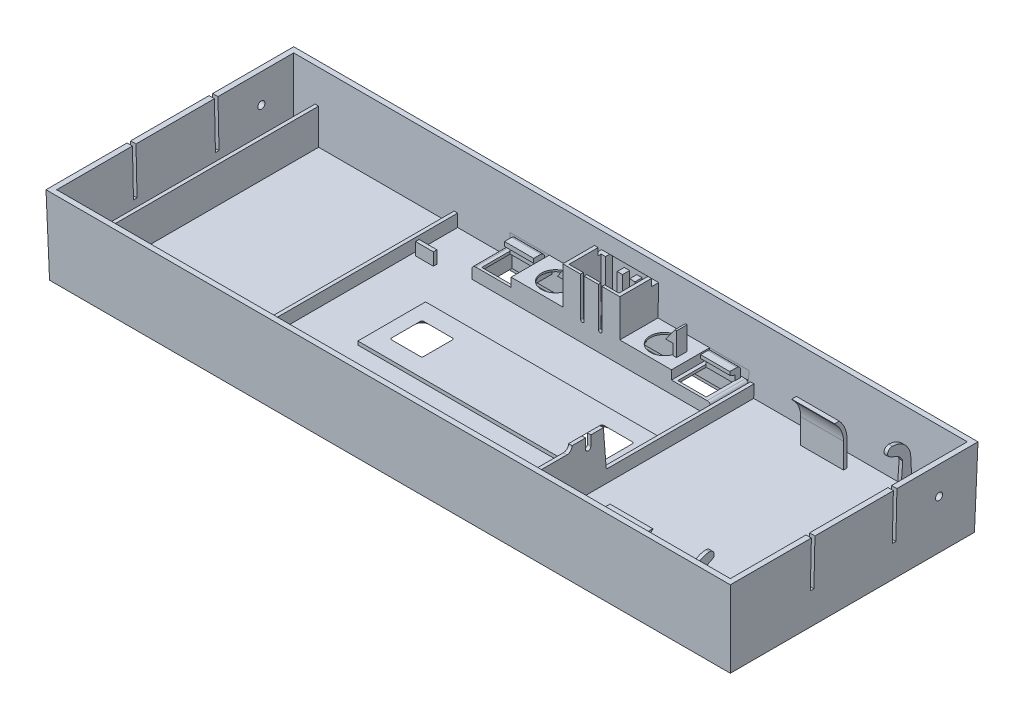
SolidWorks part; units mm, degrees
ref_plane "Plan de face" through (0, 0, 0) normal (0, 0, 1) x (1, 0, 0)
ref_plane "Plan de dessus" through (0, 0, 0) normal (0, 1, 0) x (1, 0, 0)
ref_plane "Plan de droite" through (0, 0, 0) normal (1, 0, 0) x (0, 0, -1)
sketch "Esquisse1" plane through (0, 0, 0) normal (0, 1, 0) x (1, 0, 0)
  line L1 (-95.5, 34.25) -> (95.5, 34.25)
  line L2 (-95.5, 34.25) -> (-95.5, -34.25)
  line L3 (-95.5, -34.25) -> (95.5, -34.25)
  line L4 (95.5, 34.25) -> (95.5, -34.25)
  dimension "D1" = 68.5
  dimension "D2" = 191
  dimension "D3" = 95.5
  dimension "D4" = 34.25
extrude "Extrusion1" add sketch "Esquisse1" along normal blind 22
draft "Dépouille1" type of draft neutral plane draft angle 1.3 faces to draft 2 parameters "D1"=1.3
draft "Dépouille2" type of draft neutral plane draft angle 1.3 faces to draft 2 parameters "D1"=1.3
sketch "Esquisse2" plane through (0, 0, 0) normal (0, -1, 0) x (1, 0, 0)
  line L0 (-95.5, 34.25) -> (95.5, 34.25) construction
  line L1 (-94, 32.75) -> (94, 32.75)
  line L2 (-94, 32.75) -> (-94, -32.75)
  line L3 (-94, -32.75) -> (94, -32.75)
  line L4 (94, 32.75) -> (94, -32.75)
  line L5 (-95.5, -34.25) -> (-95.5, 34.25) construction
  line L6 (95.5, -34.25) -> (-95.5, -34.25) construction
  line L7 (95.5, 34.25) -> (95.5, -34.25) construction
  dimension "D1" = 1.5
  dimension "D2" = 1.5
  dimension "D3" = 1.5
  dimension "D4" = 1.5
extrude "Enlèv. mat.-Extru.1" cut sketch "Esquisse2" against normal blind 1.5
sketch "Esquisse3" plane through (0, 1.5, 0) normal (0, -1, 0) x (1, 0, 0)
  line L0 (94, 32.75) -> (-94, 32.75) construction
  line L1 (-32, 8.25) -> (32.5, 8.25)
  line L2 (-32, 8.25) -> (-32, -7.75)
  line L3 (-32, -7.75) -> (32.5, -7.75)
  line L4 (32.5, 8.25) -> (32.5, -7.75)
  line L5 (-94, 32.75) -> (-94, -32.75) construction
  dimension "D1" = 24.5
  dimension "D2" = 64.5
  dimension "D3" = 16
  dimension "D4" = 62
extrude "Enlèv. mat.-Extru.2" cut sketch "Esquisse3" against normal blind 1
shell "Coque1" thickness 1.5
sketch "Esquisse4" plane through (0, 1.5, 0) normal (0, -1, 0) x (1, 0, 0)
  line L0 (-94, 18.25) -> (-90, 18.25)
  line L1 (-94, 32.75) -> (-94, -32.75) construction
  line L2 (-90, 18.25) -> (-90, -18.25)
  line L3 (-90, -18.25) -> (-94, -18.25)
  line L4 (-94, -18.25) -> (-94, 18.25)
  line L5 (-94, -32.75) -> (94, -32.75) construction
  line L6 (94, 32.75) -> (-94, 32.75) construction
  dimension "D1" = 4
  dimension "D2" = 14.5
  dimension "D3" = 14.5
extrude "Enlèv. mat.-Extru.3" cut sketch "Esquisse4" against normal blind 1.5
sketch "Esquisse5" plane through (0, 1.5, 0) normal (0, -1, 0) x (1, 0, 0)
  line L0 (94, 18.25) -> (90, 18.25)
  line L1 (94, -32.75) -> (94, 32.75) construction
  line L2 (90, 18.25) -> (90, -18.25)
  line L3 (90, -18.25) -> (94, -18.25)
  line L4 (94, -18.25) -> (94, 18.25)
  line L5 (94, 32.75) -> (-94, 32.75) construction
  line L6 (-94, -32.75) -> (94, -32.75) construction
  dimension "D1" = 4
  dimension "D2" = 14.5
  dimension "D3" = 14.5
extrude "Enlèv. mat.-Extru.4" cut sketch "Esquisse5" against normal blind 1.5
sketch "Esquisse6" plane through (0, 2.5, 0) normal (0, -1, 0) x (1, 0, 0)
  line L0 (-29, 4.75) -> (-21, 4.75)
  line L1 (-29, -4.25) -> (-21, -4.25)
  line L2 (-20.5, 4.25) -> (-20.5, -3.75)
  line L3 (-29.5, 4.25) -> (-29.5, -3.75)
  line L4 (-32, 8.25) -> (-32, -7.75) construction
  line L7 (32.5, 8.25) -> (-32, 8.25) construction
  line L8 (-32, -7.75) -> (32.5, -7.75) construction
  arc A0 (-21, 4.75) -> (-20.5, 4.25) centre (-21, 4.25) cw
  arc A1 (-29, 4.75) -> (-29.5, 4.25) centre (-29, 4.25) ccw
  arc A2 (-29.5, -3.75) -> (-29, -4.25) centre (-29, -3.75) ccw
  arc A3 (-21, -4.25) -> (-20.5, -3.75) centre (-21, -3.75) ccw
  dimension "D2" = 8
  dimension "D3" = 8
  dimension "D8" = 0.5
  dimension "D9" = 0.5
  dimension "D1" = 8
  dimension "D4" = 8
  dimension "D5" = 2.5
  dimension "D6" = 3.5
  dimension "D7" = 3.5
extrude "Enlèv. mat.-Extru.5" cut sketch "Esquisse6" against normal through all
sketch "Esquisse7"
  dimension "D2" = 8
  dimension "D3" = 8
  dimension "D4" = 8
  dimension "D8" = 0.5
  dimension "D9" = 0.5
  dimension "D1" = 8
  dimension "D5" = 2.5
  dimension "D6" = 3.5
  dimension "D7" = 3.5
extrude "Enlèv. mat.-Extru.6" cut sketch "Esquisse7" against normal through all
chamfer "Chanfrein1" distance 1.5 angle 45 8 edges at (-29.3536, 2.5, -4.1036) (-25, 2.5, -4.25) (-20.6464, 2.5, -4.1036) (-20.5, 2.5, 0.25) (-20.6464, 2.5, 4.6036) (-25, 2.5, 4.75) (-29.3536, 2.5, 4.6036) (-29.5, 2.5, 0.25)
chamfer "Chanfrein2" distance 1.5 angle 45 8 edges at (21.1464, 2.5, -4.1036) (25.5, 2.5, -4.25) (29.8536, 2.5, -4.1036) (30, 2.5, 0.25) (29.8536, 2.5, 4.6036) (25.5, 2.5, 4.75) (21.1464, 2.5, 4.6036) (21, 2.5, 0.25)
sketch "Esquisse8" plane through (0, 3, 0) normal (0, 1, 0) x (-1, 0, 0)
  line L0 (33.5, -33.2489) -> (-33.5, -33.2489)
  line L1 (-94.4989, -33.2489) -> (94.4989, -33.2489) construction
  line L2 (-33.5, -33.2489) -> (-33.5, -22.2489)
  line L3 (-33.5, -22.2489) -> (33.5, -22.2489)
  line L4 (33.5, -22.2489) -> (33.5, -33.2489)
  dimension "D1" = 67
  dimension "D2" = 33.5
  dimension "D3" = 11
extrude "Extrusion2" add sketch "Esquisse8" along normal blind 16.5
sketch "Esquisse9" plane through (0, 3, 0) normal (0, 1, 0) x (-1, 0, 0)
  line L0 (-34, -33.2489) -> (-34, 33.2489)
  line L1 (-94.4989, -33.2489) -> (94.4989, -33.2489) construction
  line L2 (94.4989, 33.2489) -> (-94.4989, 33.2489) construction
  line L3 (-34, 33.2489) -> (-35, 33.2489)
  line L4 (-35, 33.2489) -> (-35, -33.2489)
  line L5 (-35, -33.2489) -> (-34, -33.2489)
  line L7 (-33.5, -22.2489) -> (-33.5, -33.1921) construction
  dimension "D1" = 1
  dimension "D2" = 66.4977
  dimension "D3" = 0.5
extrude "Extrusion4" add sketch "Esquisse9" along normal blind 14
sketch "Esquisse10" plane through (35, 0, 0) normal (1, 0, 0) x (0, 0, -1)
  line L0 (32.8971, 6.5) -> (-8.1029, 6.5)
  line L1 (33.1354, 17) -> (32.8177, 3) construction
  line L2 (32.8971, 6.5) -> (33.1354, 17)
  line L3 (33.1354, 17) -> (-9.3646, 17)
  line L4 (-33.1354, 17) -> (33.1354, 17) construction
  line L5 (-9.3646, 17) -> (-8.5901, 6.9)
  arc A0 (-8.5901, 6.9) -> (-8.1029, 6.5) centre (-8.1549, 6.9334) ccw
  dimension "D2" = 10.5
  dimension "D5" = 0.4365
  dimension "D1" = 41
  dimension "D3" = 42.5
  dimension "D4" = 10.1
extrude "Enlèv. mat.-Extru.7" cut sketch "Esquisse10" against normal blind 1
sketch "Esquisse11" plane through (35, 0, 0) normal (1, 0, 0) x (0, 0, -1)
  line L0 (-33.1354, 17) -> (-33.1014, 15.5004)
  line L1 (-32.8177, 3) -> (-33.1354, 17) construction
  line L2 (-33.1014, 15.5004) -> (-19.6014, 15.5004)
  line L3 (-33.1354, 17) -> (-18.1354, 17)
  line L4 (-33.1354, 17) -> (-9.3646, 17) construction
  arc A0 (-19.6014, 15.5004) -> (-18.1354, 17) centre (-19.6014, 16.9667) ccw
  dimension "D1" = 15
  dimension "D2" = 1.5
  dimension "D3" = 13.5
extrude "Enlèv. mat.-Extru.8" cut sketch "Esquisse11" against normal blind 1
sketch "Esquisse12" plane through (35, 0, 0) normal (1, 0, 0) x (0, 0, -1)
  line L0 (-12.8646, 17) -> (-12.8646, 14.25)
  line L1 (-18.1354, 17) -> (-9.3646, 17) construction
  line L2 (-14.3646, 17) -> (-14.3646, 14.25)
  line L3 (-14.3646, 17) -> (-12.8646, 17)
  arc A0 (-14.3646, 14.25) -> (-12.8646, 14.25) centre (-13.6146, 14.25) ccw
  dimension "D2" = 0.75
  dimension "D3" = 3.5
  dimension "D1" = 2.75
extrude "Enlèv. mat.-Extru.9" cut sketch "Esquisse12" against normal blind 1
sketch "Esquisse13" plane through (0, 3, 0) normal (0, 1, 0) x (-1, 0, 0)
  line L0 (88.0677, -32.8177) -> (88.0677, 32.8177)
  line L4 (94.0677, -32.8177) -> (33.5, -32.8177) construction
  line L5 (-34, 32.8177) -> (94.0677, 32.8177) construction
  line L6 (88.0677, 32.8177) -> (87.0677, 32.8177)
  line L7 (87.0677, 32.8177) -> (87.0677, -32.8177)
  line L8 (87.0677, -32.8177) -> (88.0677, -32.8177)
  line L9 (94.0677, 32.8177) -> (94.0677, -32.8177) construction
  line L10 (0, 50.5503) -> (0, -52.0962) construction
  line L11 (-87.0677, 32.8177) -> (-87.0677, -32.8177)
  line L12 (-88.0677, -32.8177) -> (-88.0677, 32.8177)
  line L13 (-88.0677, 32.8177) -> (-87.0677, 32.8177)
  line L14 (-87.0677, -32.8177) -> (-88.0677, -32.8177)
  dimension "D1" = 1
  dimension "D2" = 6
extrude "Extrusion5" add sketch "Esquisse13" along normal blind 10
sketch "Esquisse14" plane through (0, 3, 0) normal (0, 1, 0) x (-1, 0, 0)
  line L1 (87.0677, -32.8177) -> (33.5, -32.8177) construction
  line L2 (-34, 32.8177) -> (87.0677, 32.8177) construction
  line L3 (49.0677, -32.8177) -> (48.0677, -32.8177)
  line L4 (49.0677, 32.8177) -> (48.0677, 32.8177)
  line L5 (48.0677, -32.8177) -> (48.0677, 32.8177)
  line L8 (49.0677, -32.8177) -> (49.0677, 32.8177)
  line L9 (87.0677, 32.8177) -> (87.0677, -32.8177) construction
  dimension "D1" = 38
  dimension "D2" = 1
  dimension "D3" = 1
extrude "Extrusion6" add sketch "Esquisse14" along normal blind 3.5
sketch "Esquisse15" plane through (95.4508, -2.1661, 0) normal (0.9997, -0.0227, 0) x (0, 0, -1)
  line L0 (0, -2.6704) -> (0, 30.6885) construction
  line L1 (-11, 24.1723) -> (-11, 11.1723)
  line L2 (-34.7492, 24.1723) -> (34.7492, 24.1723) construction
  line L3 (-11, 24.1723) -> (-12, 24.1723)
  line L4 (-12, 24.1723) -> (-12, 11.1723)
  line L5 (-12, 11.1723) -> (-11, 11.1723)
  line L6 (12, 11.1723) -> (11, 11.1723)
  line L7 (11, 24.1723) -> (11, 11.1723)
  line L8 (12, 24.1723) -> (12, 11.1723)
  line L9 (11, 24.1723) -> (12, 24.1723)
  dimension "D1" = 22
  dimension "D2" = 13
  dimension "D3" = 1
extrude "Enlèv. mat.-Extru.13" cut sketch "Esquisse15" against normal blind 1.5
sketch "Esquisse16" plane through (95.4508, -2.1661, 0) normal (0.9997, -0.0227, 0) x (0, 0, -1)
  line L0 (12, 24.1723) -> (34.7492, 24.1723) construction
  circle A0 centre (24, 16.1723) radius 1
  dimension "D1" = 24
  dimension "D2" = 8
extrude "Enlèv. mat.-Extru.14" cut sketch "Esquisse16" against normal blind 1.5
sketch "Esquisse17" plane through (-95.4508, -2.1661, 0) normal (-0.9997, -0.0227, 0) x (0, 0, 1)
  line L0 (0, -1.9988) -> (0, 29.793) construction
  line L1 (-12, 24.1723) -> (-12, 11.1723)
  line L2 (-34.7492, 24.1723) -> (34.7492, 24.1723) construction
  line L3 (-12, 11.1723) -> (-11, 11.1723)
  line L4 (-11, 11.1723) -> (-11, 24.1723)
  line L5 (-11, 24.1723) -> (-12, 24.1723)
  line L6 (12, 11.1723) -> (11, 11.1723)
  line L7 (11, 11.1723) -> (11, 24.1723)
  line L8 (12, 24.1723) -> (12, 11.1723)
  line L9 (11, 24.1723) -> (12, 24.1723)
  dimension "D1" = 22
  dimension "D2" = 13
  dimension "D3" = 1
extrude "Enlèv. mat.-Extru.15" cut sketch "Esquisse17" against normal blind 1.5
sketch "Esquisse18" plane through (-95.4508, -2.1661, 0) normal (-0.9997, -0.0227, 0) x (0, 0, 1)
  line L0 (-12, 24.1723) -> (-12, 11.1723) construction
  line L1 (-34.7492, 24.1723) -> (-12, 24.1723) construction
  circle A0 centre (-24, 16.1723) radius 1
  dimension "D1" = 12
  dimension "D2" = 8
extrude "Enlèv. mat.-Extru.16" cut sketch "Esquisse18" against normal blind 1.5
sketch "Esquisse19" plane through (0, 3, 0) normal (0, 1, 0) x (-1, 0, 0)
  line L0 (0, 0) -> (52.1984, 0) construction
  line L1 (48.0677, 32.8177) -> (48.0677, -32.8177) construction
  line L2 (47.0677, -21) -> (42.0677, -21)
  line L3 (47.0677, -21) -> (47.0677, -20)
  line L4 (47.0677, -20) -> (42.0677, -20)
  line L5 (42.0677, -21) -> (42.0677, -20)
  line L6 (42.0677, 21) -> (42.0677, 20)
  line L7 (47.0677, 20) -> (42.0677, 20)
  line L8 (47.0677, 21) -> (42.0677, 21)
  line L9 (47.0677, 21) -> (47.0677, 20)
  dimension "D1" = 1
  dimension "D2" = 1
  dimension "D3" = 5
  dimension "D4" = 20
extrude "Extrusion7" add sketch "Esquisse19" along normal blind 3.5
sketch "Esquisse20" plane through (0, 3, 0) normal (0, 1, 0) x (-1, 0, 0)
  line L0 (-34, 32.8177) -> (48.0677, 32.8177) construction
  line L1 (-23.5, 20.8177) -> (-26.5, 20.8177)
  line L2 (-23.5, 20.8177) -> (-23.5, 21.8177)
  line L3 (-23.5, 21.8177) -> (-26.5, 21.8177)
  line L4 (-26.5, 20.8177) -> (-26.5, 21.8177)
  line L5 (-34, 33.1014) -> (-34, 19.6014) construction
  dimension "D1" = 3
  dimension "D2" = 1
  dimension "D3" = 11
  dimension "D4" = 7.5
extrude "Extrusion8" add sketch "Esquisse20" along normal blind 3.5
sketch "Esquisse22" plane through (0, 3, 0) normal (0, 1, 0) x (-1, 0, 0)
  line L0 (0, 0) -> (-102.6284, 0) construction
  line L1 (-35, -32.8177) -> (-87.0677, -32.8177) construction
  line L2 (-81.0677, -31.3177) -> (-80.0677, -31.3177)
  line L3 (-81.0677, -31.3177) -> (-81.0677, -24.3177)
  line L4 (-81.0677, -24.3177) -> (-80.0677, -24.3177)
  line L5 (-80.0677, -31.3177) -> (-80.0677, -24.3177)
  line L6 (-87.0677, -32.8177) -> (-87.0677, 32.8177) construction
  line L7 (-81.0677, 24.3177) -> (-80.0677, 24.3177)
  line L8 (-80.0677, 31.3177) -> (-80.0677, 24.3177)
  line L9 (-81.0677, 31.3177) -> (-81.0677, 24.3177)
  line L10 (-81.0677, 31.3177) -> (-80.0677, 31.3177)
  dimension "D1" = 7
  dimension "D2" = 1
  dimension "D3" = 1.5
  dimension "D4" = 6
extrude "Extrusion10" add sketch "Esquisse22" along normal blind 15
sketch "Esquisse27" plane through (80.0677, 0, 0) normal (-1, 0, 0) x (0, 0, 1)
  line L0 (-21, 17) -> (21, 17)
  line L1 (-21, 3) -> (21, 3)
  line L2 (-31.3177, 3) -> (-24.3177, 3) construction
  line L3 (0, 0) -> (0, 26.6087) construction
  arc A0 (-21, 17) -> (-21, 3) centre (-21, 10) ccw
  arc A1 (21, 17) -> (21, 3) centre (21, 10) cw
  dimension "D4" = 21
  dimension "D1" = 42
  dimension "D2" = 14
  dimension "D3" = 14
extrude "Enlèv. mat.-Extru.21" cut sketch "Esquisse27" against normal blind 1
sketch "Esquisse28" plane through (80.0677, 0, 0) normal (-1, 0, 0) x (0, 0, 1)
  line L0 (0, 0) -> (0, 31.7812) construction
  line L1 (-31.3177, 3) -> (-30.8105, 13)
  line L2 (31.3177, 3) -> (30.8105, 13)
  line L3 (-31.3177, 18) -> (-24.3177, 18) construction
  line L4 (-31.3177, 3) -> (-31.3177, 18)
  line L5 (-31.3177, 18) -> (-25.7223, 18)
  line L6 (31.3177, 18) -> (25.7223, 18)
  line L7 (31.3177, 3) -> (31.3177, 18)
  arc A0 (-30.8105, 13) -> (-25.7223, 18) centre (-25.5475, 12.7331) cw
  arc A1 (30.8105, 13) -> (25.7223, 18) centre (25.5475, 12.7331) ccw
  dimension "D3" = 5.2698
  dimension "D1" = 10
  dimension "D2" = 0.5072
extrude "Enlèv. mat.-Extru.22" cut sketch "Esquisse28" against normal blind 1
sketch "Esquisse29" plane through (80.0677, 0, 0) normal (-1, 0, 0) x (0, 0, 1)
  line L0 (0, 0) -> (0, 33.0676) construction
  line L1 (-27.8177, 3) -> (-28.5655, 13)
  line L2 (-31.3177, 3) -> (-24.3177, 3) construction
  line L3 (-25.5953, 18) -> (-24.1217, 18)
  line L5 (-25.7223, 18) -> (-24.3177, 18) construction
  line L6 (-24.7914, 15.7748) -> (-26.6683, 15.0049)
  line L7 (-24.3177, 18) -> (-24.3177, 16.1638) construction
  line L9 (-24.3177, 3) -> (-27.8177, 3)
  line L12 (-24.1217, 18) -> (-24.3177, 3)
  line L13 (25.5953, 18) -> (24.1217, 18)
  line L14 (24.1217, 18) -> (24.3177, 3)
  line L15 (24.7914, 15.7748) -> (26.6683, 15.0049)
  line L16 (27.8177, 3) -> (28.5655, 13)
  line L17 (24.3177, 3) -> (27.8177, 3)
  arc A1 (-25.5953, 18) -> (-24.7914, 15.7748) centre (-25.5953, 16.7422) cw
  arc A2 (-26.6683, 15.0049) -> (-28.5655, 13) centre (-25.3943, 11.8992) ccw
  arc A3 (25.5953, 18) -> (24.7914, 15.7748) centre (25.5953, 16.7422) ccw
  arc A4 (26.6683, 15.0049) -> (28.5655, 13) centre (25.3943, 11.8992) cw
  dimension "D3" = 2.245
  dimension "D5" = 3.3568
  dimension "D6" = 1.2578
  dimension "D1" = 3.5
  dimension "D2" = 10
  dimension "D4" = 2.0287
  dimension "D7" = 1.2776
  dimension "D8" = 1.0766
  dimension "D9" = 15
extrude "Enlèv. mat.-Extru.23" cut sketch "Esquisse29" against normal blind 1
sketch "Esquisse30" plane through (0, 3, 0) normal (0, 1, 0) x (-1, 0, 0)
  line L0 (0, -46.4128) -> (0, 42.4117) construction
  line L1 (-116.2321, 0) -> (105.029, 0) construction
  line L2 (90, -7.5) -> (90, 7.5)
  line L3 (90, -18.25) -> (90, 18.25) construction
  line L4 (90, 7.5) -> (89, 7.5)
  line L5 (89, 7.5) -> (89, -7.5)
  line L6 (89, -7.5) -> (90, -7.5)
  line L7 (-90, 7.5) -> (-89, 7.5)
  line L8 (-90, -7.5) -> (-90, 7.5)
  line L9 (-89, 7.5) -> (-89, -7.5)
  line L10 (-89, -7.5) -> (-90, -7.5)
  dimension "D1" = 1
  dimension "D2" = 15
  dimension "D3" = 7.5
extrude "Extrusion11" add sketch "Esquisse30" along normal blind 4
sketch "Esquisse31" plane through (-90, 0, 0) normal (-1, 0, 0) x (0, 0, 1)
  line L0 (-12.5344, 3) -> (8.8412, 3) construction
  line L1 (32.8177, 3) -> (-32.8177, 3) construction
  line L2 (0, 0) -> (0, 10.0487) construction
  line L3 (-7.5, 7) -> (-5.5, 7)
  line L4 (-7.5, 7) -> (7.5, 7) construction
  line L5 (-5.5, 7) -> (-5.5, 5)
  line L6 (-5.5, 5) -> (-7.5, 5)
  line L7 (-7.5, 5) -> (-7.5, 7)
  line L8 (5.5, 5) -> (7.5, 5)
  line L9 (5.5, 7) -> (5.5, 5)
  line L10 (7.5, 7) -> (5.5, 7)
  line L11 (7.5, 5) -> (7.5, 7)
  dimension "D1" = 2
  dimension "D2" = 2
  dimension "D3" = 11
extrude "Extrusion12" add sketch "Esquisse31" along normal blind 1
ref_plane "Plan1" through (-90, 5, -7.5) normal (0, -1, 0) x (1, 0, 0)
sketch "Esquisse34" plane through (0, 0, -7.5) normal (0, 0, -1) x (-1, 0, 0)
  line L0 (90, 5) -> (91, 7)
  line L1 (91, 7) -> (91, 5)
  line L2 (91, 5) -> (90, 5)
extrude "Enlèv. mat.-Extru.25" cut sketch "Esquisse34" against normal blind 15
sketch "Esquisse35" plane through (90, 0, 0) normal (1, 0, 0) x (0, 0, -1)
  line L0 (-7.2744, 3) -> (6.7148, 3) construction
  line L1 (32.8177, 3) -> (-32.8177, 3) construction
  line L2 (0, 0) -> (0, 14.4134) construction
  line L3 (-5.5, 5) -> (-5.5, 7)
  line L5 (-7.5, 7) -> (7.5, 7) construction
  line L6 (-5.5, 7) -> (-7.5, 7)
  line L7 (-7.5, 7) -> (-7.5, 5)
  line L8 (-7.5, 5) -> (-5.5, 5)
  line L9 (5.5, 5) -> (5.5, 7)
  line L10 (7.5, 5) -> (5.5, 5)
  line L11 (7.5, 7) -> (7.5, 5)
  line L12 (5.5, 7) -> (7.5, 7)
  dimension "D1" = 2
  dimension "D2" = 11
  dimension "D3" = 2
extrude "Extrusion14" add sketch "Esquisse35" along normal blind 1
sketch "Esquisse36" plane through (0, 0, -7.5) normal (0, 0, -1) x (-1, 0, 0)
  line L0 (-90, 5) -> (-91, 7)
  line L1 (-91, 7) -> (-91, 5)
  line L2 (-91, 5) -> (-90, 5)
extrude "Enlèv. mat.-Extru.26" cut sketch "Esquisse36" against normal blind 15
sketch "Esquisse38" plane through (0, -0.7428, 32.7328) normal (0, 0.0227, -0.9997) x (-1, 0, 0)
  line L0 (40.0677, 13.2438) -> (40.0677, 8.2438)
  line L1 (40.0677, 8.2438) -> (34.0677, 8.2438)
  line L2 (34.0677, 13.2438) -> (35.0677, 13.2438)
  line L3 (35.0677, 13.2438) -> (35.0677, 9.2438)
  line L4 (40.0677, 13.2438) -> (39.0677, 13.2438)
  line L5 (39.0677, 13.2438) -> (39.0677, 9.2438)
  line L6 (39.0677, 9.2438) -> (35.0677, 9.2438)
  line L7 (34.0677, 13.2438) -> (34.0677, 8.2438)
  line L8 (48.0677, 7.2429) -> (48.0677, 3.7438) construction
  line L9 (-34, 3.7438) -> (48.0677, 3.7438) construction
  dimension "D1" = 8
  dimension "D2" = 1
  dimension "D3" = 5
  dimension "D4" = 4
  dimension "D5" = 1
  dimension "D6" = 6
  dimension "D7" = 4.5
extrude "Extrusion15" add sketch "Esquisse38" along normal blind 2
sketch "Esquisse39" plane through (-40.0677, 0, 0) normal (-1, 0, 0) x (0, 0, 1)
  line L0 (30.9657, 9.5437) -> (33.0332, 12.4976)
  line L1 (30.9203, 7.5442) -> (31.0337, 12.5429) construction
  line L2 (30.9203, 7.5442) -> (32.9198, 7.4988) construction
  line L3 (30.9657, 9.5437) -> (31.0337, 12.5429)
  line L4 (31.0337, 12.5429) -> (33.0332, 12.4976)
  dimension "D1" = 2
extrude "Enlèv. mat.-Extru.27" cut sketch "Esquisse39" against normal blind 6
sketch "Esquisse40" plane through (0, -0.7428, 32.7328) normal (0, 0.0227, -0.9997) x (-1, 0, 0)
  line L0 (0, 0) -> (0, 36.7181) construction
  line L1 (-7, 22.7487) -> (-7, 17.7487)
  line L2 (94.4989, 22.7487) -> (-94.4989, 22.7487) construction
  line L3 (7, 22.7487) -> (7, 17.7487)
  line L4 (-7, 22.7487) -> (7, 22.7487)
  arc A0 (-7, 17.7487) -> (7, 17.7487) centre (0, 17.7487) ccw
  dimension "D1" = 5
  dimension "D2" = 14
  dimension "D3" = 7
extrude "Enlèv. mat.-Extru.28" cut sketch "Esquisse40" against normal blind 0.5
sketch "Esquisse41" plane through (0, 1.5, 0) normal (0, -1, 0) x (1, 0, 0)
  line L0 (0, 0) -> (0, -60.4167) construction
  line L1 (-94, -32.75) -> (94, -32.75) construction
  line L2 (32, -23) -> (-32, -23)
  line L3 (32, -23) -> (32, -32)
  line L4 (32, -32) -> (-32, -32)
  line L5 (-32, -23) -> (-32, -32)
  dimension "D1" = 64
  dimension "D2" = 9
  dimension "D3" = 32
  dimension "D4" = 0.75
extrude "Enlèv. mat.-Extru.29" cut sketch "Esquisse41" against normal blind 4.25
sketch "Esquisse42" plane through (0, 1.5, 0) normal (0, -1, 0) x (1, 0, 0)
  line L0 (0, 0) -> (0, -58.016) construction
  line L1 (32, -23) -> (-32, -23) construction
  line L2 (31.5, -23) -> (23.5, -23)
  line L3 (31.5, -23) -> (31.5, -31)
  line L4 (31.5, -31) -> (23.5, -31)
  line L5 (23.5, -23) -> (23.5, -31)
  line L6 (32, -32) -> (32, -23) construction
  line L7 (-31.5, -31) -> (-23.5, -31)
  line L8 (-31.5, -23) -> (-31.5, -31)
  line L9 (-23.5, -23) -> (-23.5, -31)
  line L10 (-31.5, -23) -> (-23.5, -23)
  dimension "D1" = 8
  dimension "D2" = 8
  dimension "D3" = 0.5
  dimension "D4" = 8
extrude "Enlèv. mat.-Extru.30" cut sketch "Esquisse42" against normal through all
sketch "Esquisse43" plane through (0, 5.75, 0) normal (0, -1, 0) x (1, 0, 0)
  line L0 (0, 0) -> (0, -60.4167) construction
  line L1 (23.5, -31) -> (23.5, -23) construction
  line L2 (20.75, -23) -> (-20.75, -23)
  line L3 (20.75, -23) -> (20.75, -32)
  line L4 (20.75, -32) -> (-20.75, -32)
  line L5 (-20.75, -23) -> (-20.75, -32)
  line L6 (-23.5, -23) -> (-23.5, -31) construction
  line L8 (-32, -32) -> (32, -32) construction
  dimension "D1" = 2.75
  dimension "D2" = 2.75
  dimension "D3" = 9
  dimension "D4" = 9
extrude "Enlèv. mat.-Extru.31" cut sketch "Esquisse43" against normal blind 2.75
sketch "Esquisse44" plane through (0, 8.5, 0) normal (0, -1, 0) x (1, 0, 0)
  line L0 (0, 0) -> (0, -52.0144) construction
  line L1 (-32, -32) -> (32, -32) construction
  line L2 (7, -23) -> (-7, -23)
  line L3 (7, -23) -> (7, -32)
  line L4 (7, -32) -> (-7, -32)
  line L5 (-7, -23) -> (-7, -32)
  dimension "D1" = 14
  dimension "D2" = 7
  dimension "D3" = 9
  dimension "D4" = 9
extrude "Enlèv. mat.-Extru.32" cut sketch "Esquisse44" against normal through all
sketch "Esquisse45" plane through (0, 8.5, 0) normal (0, -1, 0) x (1, 0, 0)
  line L0 (20.75, -32) -> (20.75, -23) construction
  line L1 (-32, -32) -> (32, -32) construction
  line L2 (0, 0) -> (0, -38.2871) construction
  circle A0 centre (15.25, -27.5) radius 4
  circle A1 centre (-15.25, -27.5) radius 4
  dimension "D1" = 8
  dimension "D2" = 5.5
  dimension "D3" = 4.5
extrude "Enlèv. mat.-Extru.33" cut sketch "Esquisse45" against normal through all
sketch "Esquisse46" plane through (0, 19.5, 0) normal (0, 1, 0) x (-1, 0, 0)
  line L0 (0, 0) -> (0, -52.0144) construction
  line L1 (-94.4989, -33.2489) -> (94.4989, -33.2489) construction
  line L2 (8, -33.2489) -> (33.5, -33.2489)
  line L3 (8, -33.2489) -> (8, -22.2489)
  line L4 (8, -22.2489) -> (33.5, -22.2489)
  line L5 (33.5, -33.2489) -> (33.5, -22.2489)
  line L6 (-8, -22.2489) -> (-33.5, -22.2489)
  line L7 (-33.5, -33.2489) -> (-33.5, -22.2489)
  line L8 (-8, -33.2489) -> (-33.5, -33.2489)
  line L9 (-8, -33.2489) -> (-8, -22.2489)
  dimension "D1" = 8
  dimension "D2" = 11
  dimension "D3" = 11
  dimension "D4" = 25.5
extrude "Enlèv. mat.-Extru.34" cut sketch "Esquisse46" against normal blind 10.5
sketch "Esquisse47" plane through (-33.5, 0, 0) normal (1, 0, 0) x (0, 0, -1)
  line L0 (32.9539, 9) -> (33.2489, 9)
  line L2 (32.9539, 9) -> (33.2011, 19.8959)
  line L3 (33.2011, 19.8959) -> (33.4762, 19.8959)
  line L4 (33.4762, 19.8959) -> (33.2489, 9)
extrude "Extrusion18" add sketch "Esquisse47" along normal blind 26
sketch "Esquisse48" plane through (33.5, 0, 0) normal (-1, 0, 0) x (0, 0, 1)
  line L0 (-32.9539, 9) -> (-33.1952, 19.6335)
  line L1 (-33.1952, 19.6335) -> (-33.3374, 19.5729)
  line L2 (-33.3374, 19.5729) -> (-33.2489, 9)
  line L3 (-33.2489, 9) -> (-32.9539, 9)
extrude "Extrusion19" add sketch "Esquisse48" along normal blind 26
sketch "Esquisse49" plane through (0, 9, 0) normal (0, 1, 0) x (-1, 0, 0)
  line L0 (0, 0) -> (0, -72.42) construction
  line L3 (8, -32.9539) -> (33.5, -32.9539) construction
  line L4 (22.5, -32.9539) -> (33.5, -32.9539)
  line L5 (22.5, -32.9539) -> (22.5, -21.9539)
  line L8 (22.5, -21.9539) -> (33.5, -21.9539)
  line L9 (33.5, -32.9539) -> (33.5, -21.9539)
  line L10 (33.5, -32.9539) -> (33.5, -22.2489) construction
  line L11 (-22.5, -21.9539) -> (-33.5, -21.9539)
  line L12 (-33.5, -32.9539) -> (-33.5, -21.9539)
  line L13 (-22.5, -32.9539) -> (-22.5, -21.9539)
  line L14 (-22.5, -32.9539) -> (-33.5, -32.9539)
  dimension "D1" = 11
  dimension "D2" = 11
  dimension "D3" = 11
  dimension "D4" = 11
extrude "Enlèv. mat.-Extru.36" cut sketch "Esquisse49" against normal blind 2.5
sketch "Esquisse53" plane through (0, 6.5, 0) normal (0, 1, 0) x (-1, 0, 0)
  line L0 (0, 0) -> (0, -39.4915) construction
  line L1 (23.5, -31) -> (31.5, -31) construction
  line L2 (23.4, -32.5) -> (31.6, -32.5)
  line L3 (23.4, -32.5) -> (23.4, -29.5)
  line L4 (23.4, -29.5) -> (31.6, -29.5)
  line L5 (31.6, -32.5) -> (31.6, -29.5)
  line L7 (23.5, -23) -> (23.5, -31) construction
  line L8 (-31.6, -32.5) -> (-31.6, -29.5)
  line L9 (-23.4, -29.5) -> (-31.6, -29.5)
  line L10 (-23.4, -32.5) -> (-31.6, -32.5)
  line L11 (-23.4, -32.5) -> (-23.4, -29.5)
  dimension "D1" = 3
  dimension "D2" = 1.5
  dimension "D3" = 8.2
  dimension "D4" = 8.1
extrude "Extrusion25" add sketch "Esquisse53" along normal blind 3
sketch "Esquisse54" plane through (-31.6, 0, 0) normal (-1, 0, 0) x (0, 0, 1)
  line L0 (-32.5, 6.5) -> (-29.5, 6.5) construction
  line L1 (-31, 8) -> (-29.5, 8)
  line L2 (-31, 8) -> (-31, 6.5)
  line L3 (-31, 6.5) -> (-29.5, 6.5)
  line L4 (-29.5, 8) -> (-29.5, 6.5)
  line L5 (-29.5, 9.5) -> (-29.5, 6.5) construction
  dimension "D1" = 1.5
  dimension "D2" = 1.5
  dimension "D3" = 1.5
  dimension "D4" = 1.5
extrude "Enlèv. mat.-Extru.37" cut sketch "Esquisse54" against normal blind 8.2
sketch "Esquisse55" plane through (31.6, 0, 0) normal (1, 0, 0) x (0, 0, -1)
  line L0 (29.5, 6.5) -> (32.5, 6.5) construction
  line L1 (29.5, 8) -> (31, 8)
  line L2 (29.5, 8) -> (29.5, 6.5)
  line L3 (29.5, 6.5) -> (31, 6.5)
  line L4 (31, 8) -> (31, 6.5)
  line L5 (29.5, 9.5) -> (29.5, 6.5) construction
  dimension "D1" = 1.5
  dimension "D2" = 1.5
  dimension "D3" = 1.5
  dimension "D4" = 1.5
extrude "Enlèv. mat.-Extru.38" cut sketch "Esquisse55" against normal blind 8.2
fillet "Congé2" radius 1 1 edges at (27.5, 9.5, -32.5)
chamfer "Chanfrein3" distance 1 angle 30 1 edges at (27.5, 8, -29.5)
fillet "Congé3" radius 1 1 edges at (-27.5, 9.5, -32.5)
chamfer "Chanfrein4" distance 0.5 angle 30 1 edges at (-27.5, 8, -29.5)
fillet "Congé4" radius 1 1 edges at (-33.5, 6.5, -27.573)
fillet "Congé5" radius 1 1 edges at (33.5, 6.5, -27.573)
sketch "Esquisse56" plane through (0, 9, 0) normal (0, 1, 0) x (-1, 0, 0)
  line L0 (-14.8406, -27.4147) -> (-26.4264, -27.4147) construction
  line L1 (-8, -22.2489) -> (-22.5, -22.2489) construction
  line L2 (-20.25, -28.9189) -> (-17.25, -28.9189)
  line L3 (-20.25, -28.9189) -> (-20.25, -25.9189)
  line L4 (-20.25, -25.9189) -> (-17.25, -25.9189)
  line L5 (-17.25, -28.9189) -> (-17.25, -25.9189)
  line L6 (-15.25, -32) -> (-15.25, -20.1969) construction
  line L7 (-7, -32) -> (-20.75, -32) construction
  line L9 (-19.25, -30.7181) -> (-19.25, -23.5787) construction
  line L10 (-22.5, -32.9539) -> (-22.5, -22.2489) construction
  dimension "D4" = 1
  dimension "D1" = 3
  dimension "D2" = 6.67
  dimension "D3" = 3
  dimension "D5" = 2.25
sketch "Esquisse57" plane through (0, 9, 0) normal (0, 1, 0) x (-1, 0, 0)
  line L0 (15.2094, -31.0033) -> (15.2094, -20.8266) construction
  line L1 (15.25, -27.5) -> (7, -27.5) construction
  line L2 (7, -23) -> (7, -32) construction
  line L3 (11.25, -29.9631) -> (11.25, -24.2641) construction
  line L4 (10.25, -29) -> (13.25, -29)
  line L5 (10.25, -29) -> (10.25, -26)
  line L6 (10.25, -26) -> (13.25, -26)
  line L7 (13.25, -29) -> (13.25, -26)
  line L8 (8, -22.2489) -> (8, -33.1921) construction
  dimension "D1" = 3
  dimension "D2" = 1.5
  dimension "D3" = 3
  dimension "D4" = 1
  dimension "D5" = 2.25
extrude "Extrusion27" add sketch "Esquisse57" along normal blind 6.5
extrude "Extrusion28" add sketch "Esquisse56" along normal blind 6.5 contours L5 L4 L3 L2
sketch "Esquisse58" plane through (0, 0, -26) normal (0, 0, 1) x (1, 0, 0)
  line L0 (-10.75, 15.5) -> (-13.25, 12)
  line L1 (-13.25, 15.5) -> (-10.25, 15.5) construction
  line L2 (-13.25, 15.5) -> (-13.25, 9) construction
  line L3 (-13.25, 12) -> (-13.25, 15.5)
  line L4 (-13.25, 15.5) -> (-10.75, 15.5)
  dimension "D1" = 2.5
  dimension "D2" = 3.5
extrude "Enlèv. mat.-Extru.39" cut sketch "Esquisse58" against normal blind 3
sketch "Esquisse59" plane through (0, 0, -26) normal (0, 0, 1) x (1, 0, 0)
  line L1 (-13.25, 12) -> (-13.25, 9) construction
  line L2 (-13.25, 11.99) -> (-11.25, 11.99)
  line L3 (-13.25, 11.99) -> (-13.25, 9)
  line L4 (-13.25, 9) -> (-11.25, 9)
  line L6 (-11.25, 11.99) -> (-11.25, 9)
  line L7 (-11.5419, 9) -> (-10.25, 9) construction
  dimension "D1" = 2
  dimension "D2" = 2
  dimension "D3" = 2.99
  dimension "D4" = 2.99
extrude "Enlèv. mat.-Extru.40" cut sketch "Esquisse59" against normal blind 3
sketch "Esquisse60" plane through (0, 0, -25.9189) normal (0, 0, 1) x (1, 0, 0)
  line L0 (19.75, 15.5) -> (17.25, 12)
  line L1 (20.25, 15.5) -> (17.25, 15.5) construction
  line L2 (17.25, 15.5) -> (17.25, 9) construction
  line L3 (17.25, 12) -> (17.25, 15.5)
  line L4 (17.25, 15.5) -> (19.75, 15.5)
  dimension "D1" = 2.5
  dimension "D2" = 3.5
extrude "Enlèv. mat.-Extru.41" cut sketch "Esquisse60" against normal blind 3
sketch "Esquisse61" plane through (0, 0, -25.9189) normal (0, 0, 1) x (1, 0, 0)
  line L0 (20.25, 9) -> (18.9242, 9) construction
  line L1 (17.25, 11.99) -> (19.25, 11.99)
  line L2 (17.25, 11.99) -> (17.25, 9)
  line L3 (17.25, 9) -> (19.25, 9)
  line L4 (19.25, 11.99) -> (19.25, 9)
  dimension "D1" = 2.99
  dimension "D2" = 2.99
  dimension "D3" = 2
  dimension "D4" = 2
extrude "Enlèv. mat.-Extru.42" cut sketch "Esquisse61" against normal blind 3
sketch "Esquisse62" plane through (0, 0, -22.2489) normal (0, 0, 1) x (1, 0, 0)
  line L0 (0, -9.3688) -> (0, 44.543) construction
  line L1 (-8, 19.5) -> (8, 19.5) construction
  line L2 (-3, 22.3726) -> (-2, 22.3726)
  line L3 (-3, 22.3726) -> (-3, 8)
  line L4 (-3, 8) -> (-2, 8)
  line L5 (-2, 22.3726) -> (-2, 8)
  line L6 (3, 8) -> (2, 8)
  line L7 (2, 22.3726) -> (2, 8)
  line L8 (3, 22.3726) -> (3, 8)
  line L9 (3, 22.3726) -> (2, 22.3726)
  dimension "D1" = 1
  dimension "D2" = 11.5
  dimension "D3" = 4
extrude "Enlèv. mat.-Extru.43" cut sketch "Esquisse62" against normal blind 3
fillet "Congé6" radius 0.5 1 edges at (-3, 8, -22.6244)
fillet "Congé7" radius 0.5 1 edges at (-2, 8, -22.6244)
fillet "Congé8" radius 0.5 1 edges at (3, 8, -22.6244)
fillet "Congé9" radius 0.5 1 edges at (2, 8, -22.6244)
sketch "Esquisse63" plane through (0, 0, -23) normal (0, 0, -1) x (-1, 0, 0)
  line L0 (-2, 19.5) -> (-2, 8.5) construction
  line L1 (-2, 15) -> (2, 15)
  line L2 (-2, 15) -> (-2, 11.5)
  line L3 (-2, 11.5) -> (2, 11.5)
  line L4 (2, 15) -> (2, 11.5)
  line L5 (2, 8.5) -> (2, 19.5) construction
  line L6 (-2, 19.5) -> (2, 19.5) construction
  line L7 (-4.7371, 1.5) -> (4.0661, 1.5) construction
  line L8 (-32, 1.5) -> (32, 1.5) construction
  dimension "D1" = 4.5
  dimension "D2" = 10
extrude "Extrusion29" add sketch "Esquisse63" along normal blind 4.5
sketch "Esquisse64" plane through (-2, 0, 0) normal (-1, 0, 0) x (0, 0, 1)
  line L0 (-24.4667, 11.5) -> (-22.0218, 11.5) construction
  line L1 (-27.5, 11.5) -> (-23, 11.5) construction
  line L2 (-22.6523, 15.0426) -> (-28.0966, 15.0426) construction
  line L3 (-23, 15.7973) -> (-23, 10.6103) construction
  line L4 (-23, 19.5) -> (-23, 8.5) construction
  line L5 (-27.5, 15.5) -> (-27.5, 11.1696) construction
  line L6 (-29, 15.5) -> (-26, 15.5) construction
  line L7 (-26.84, 15.0426) -> (-27.5, 14.1024)
  line L8 (-27.5, 14.1024) -> (-23.2442, 11.5)
  line L9 (-23.2442, 11.5) -> (-23.2442, 11.1696)
  line L10 (-23.2442, 11.1696) -> (-28.2678, 11.1696)
  line L11 (-28.2678, 11.1696) -> (-28.2678, 15.5)
  line L12 (-28.2678, 15.5) -> (-26.84, 15.5)
  line L13 (-26.84, 15.5) -> (-26.84, 15.0426)
extrude "Enlèv. mat.-Extru.44" cut sketch "Esquisse64" against normal blind 4
sketch "Esquisse65" plane through (8, 0, 0) normal (1, 0, 0) x (0, 0, -1)
  line L0 (33.1921, 19.5) -> (33.1467, 17.5)
  line L1 (33.1921, 19.5) -> (32.9539, 9) construction
  line L2 (33.1467, 17.5) -> (31.1467, 17.5)
  line L3 (31.1467, 17.5) -> (31.1467, 19.5)
  line L4 (33.1921, 19.5) -> (22.2489, 19.5) construction
  line L5 (31.1467, 19.5) -> (33.1921, 19.5)
  dimension "D1" = 2
  dimension "D2" = 2
extrude "Enlèv. mat.-Extru.45" cut sketch "Esquisse65" against normal blind 17
sketch "Esquisse66" plane through (0, 0, -32) normal (0, 0, 1) x (1, 0, 0)
  line L0 (0, 1.5) -> (0, 34.1047) construction
  line L1 (-32, 1.5) -> (32, 1.5) construction
  line L2 (-5.75, 17.5) -> (-5.75, 2.5)
  line L3 (7, 17.5) -> (-7, 17.5) construction
  line L4 (-5.75, 2.5) -> (-2.5, 2.5)
  line L5 (-2.5, 2.5) -> (-2.5, 15.5)
  line L6 (-2.5, 15.5) -> (-1, 15.5)
  line L7 (-1, 15.5) -> (-1, 2.5)
  line L8 (-1, 2.5) -> (1, 2.5)
  line L9 (-5.75, 17.5) -> (5.75, 17.5)
  line L10 (1, 15.5) -> (1, 2.5)
  line L11 (2.5, 15.5) -> (1, 15.5)
  line L12 (2.5, 2.5) -> (2.5, 15.5)
  line L13 (5.75, 2.5) -> (2.5, 2.5)
  line L14 (5.75, 17.5) -> (5.75, 2.5)
  point P16 (0, 2.5)
  point P21 (0, 17.5)
  dimension "D1" = 2
  dimension "D2" = 1.5
  dimension "D3" = 11.5
  dimension "D4" = 2
  dimension "D5" = 15
  dimension "D6" = 15
extrude "Enlèv. mat.-Extru.46" cut sketch "Esquisse66" against normal blind 2
sketch "Esquisse67" plane through (0, 3, 0) normal (0, 1, 0) x (-1, 0, 0)
  line L0 (-3.4009, 0) -> (-105.4291, 0) construction
  line L1 (-35, 8.1029) -> (-35, -32.8971) construction
  line L2 (-65, -29) -> (-53, -29)
  line L3 (-65, -29) -> (-65, -25.5)
  line L4 (-65, -25.5) -> (-53, -25.5)
  line L5 (-53, -29) -> (-53, -25.5)
  line L6 (-53, 29) -> (-53, 25.5)
  line L7 (-65, 25.5) -> (-53, 25.5)
  line L8 (-65, 29) -> (-65, 25.5)
  line L9 (-65, 29) -> (-53, 29)
  dimension "D1" = 3.5
  dimension "D2" = 12
  dimension "D3" = 29
  dimension "D4" = 18
extrude "Extrusion30" add sketch "Esquisse67" along normal blind 12.5
sketch "Esquisse69" plane through (53, 0, 0) normal (-1, 0, 0) x (0, 0, 1)
  line L0 (0, 0) -> (0, 31.8719) construction
  line L1 (-31.7963, 10) -> (-20.7895, 10) construction
  line L2 (-29, 3) -> (-25.5, 3) construction
  line L3 (-29, 15.5) -> (-29, 3) construction
  line L4 (-29, 10) -> (-29, 15.5)
  line L5 (-21, 14.5221) -> (-21, 7.8622) construction
  line L6 (-28, 3) -> (-28, 10)
  line L8 (-25.5, 15.5) -> (-25.5, 3) construction
  line L9 (-25.5, 15.3619) -> (-25.5, 3)
  line L10 (-25.5, 3) -> (-28, 3)
  line L11 (-29, 15.5) -> (-25.5, 15.5) construction
  line L12 (-26.8095, 15.5) -> (-29, 15.5)
  line L13 (28, 3) -> (28, 10)
  line L14 (25.5, 3) -> (28, 3)
  line L15 (25.5, 15.3619) -> (25.5, 3)
  line L16 (29, 10) -> (29, 15.5)
  line L17 (26.8095, 15.5) -> (29, 15.5)
  arc A0 (-28, 10) -> (-25.5, 15.3619) centre (-21, 10) cw
  arc A1 (-29, 10) -> (-26.8095, 15.5) centre (-21, 10) cw
  arc A2 (28, 10) -> (25.5, 15.3619) centre (21, 10) ccw
  arc A3 (29, 10) -> (26.8095, 15.5) centre (21, 10) ccw
  dimension "D2" = 7
  dimension "D1" = 7
  dimension "D3" = 1
extrude "Enlèv. mat.-Extru.47" cut sketch "Esquisse69" against normal blind 12.5
